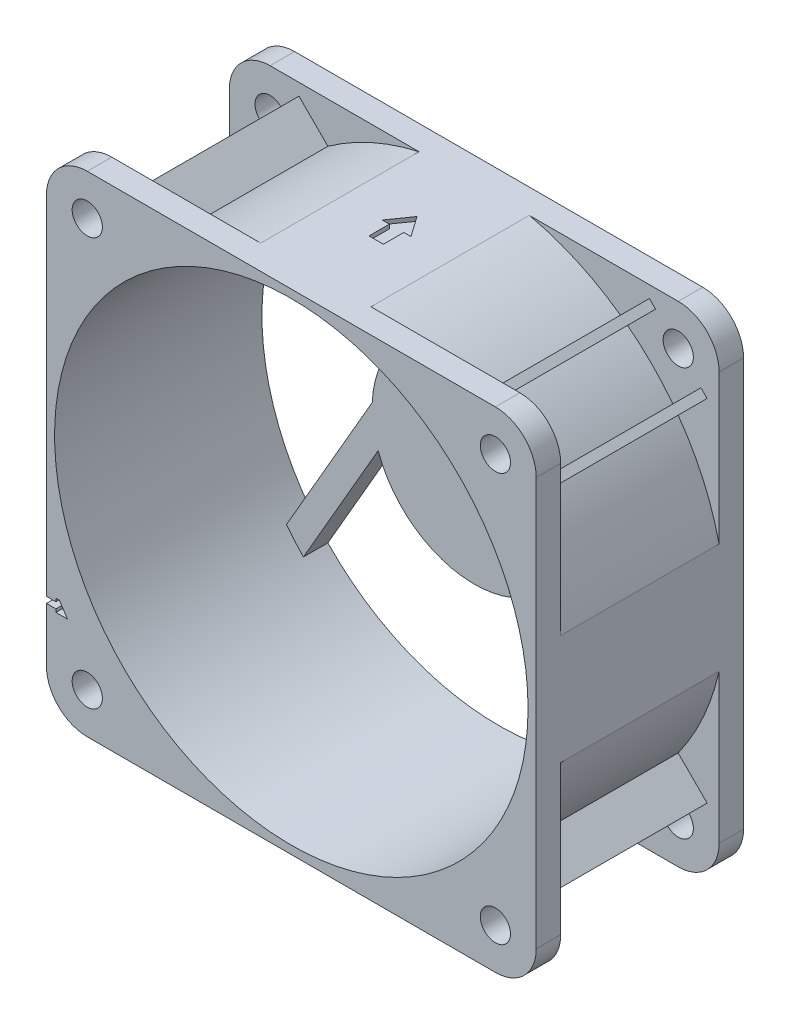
SolidWorks part; units mm, degrees
ref_plane "Front" through (0, 0, 0) normal (0, 0, 1) x (1, 0, 0)
ref_plane "Top" through (0, 0, 0) normal (0, 1, 0) x (1, 0, 0)
ref_plane "Right" through (0, 0, 0) normal (1, 0, 0) x (0, 0, -1)
sketch "Support-Front" plane through (0, 0, 0) normal (0, 0, 1) x (1, 0, 0)
  line L0 (-30, 0) -> (30, 0) construction
  line L1 (0, 30) -> (0, -30) construction
  line L2 (30, -25) -> (30, 25)
  line L3 (-30, -25) -> (-30, 25)
  line L4 (25, 30) -> (-25, 30)
  line L5 (25, -30) -> (-25, -30)
  line L6 (0, 30) -> (0, 40.3553) construction
  arc A0 (30, 25) -> (25, 30) centre (25, 25) ccw
  arc A1 (-30, 25) -> (-25, 30) centre (-25, 25) cw
  arc A2 (-30, -25) -> (-25, -30) centre (-25, -25) ccw
  arc A3 (30, -25) -> (25, -30) centre (25, -25) cw
  circle A4 centre (25, 25) radius 1.85
  circle A5 centre (-25, 25) radius 1.85
  circle A6 centre (-25, -25) radius 1.85
  circle A7 centre (25, -25) radius 1.85
  circle A8 centre (0, 0) radius 29
  circle A9 centre (0, 0) radius 12.5
  circle A10 centre (0, 0) radius 30
  circle A11 centre (0, 0) radius 40.3553 construction
  dimension "Diam-Fixing-Hole" = 3.7
  dimension "Diam-Fan-Hole" = 58
  dimension "Diam-Fixing-Plate-Fan" = 25
  dimension "Width" = 60
  dimension "Dist-Fixing-Hole" = 50
sketch "Support-Right" plane through (0, 0, 0) normal (1, 0, 0) x (0, 0, -1)
  line L0 (-25.4, 0) -> (0, 0) construction
  line L1 (-12.7, 30) -> (-12.7, -30) construction
  line L2 (-3, 30) -> (-3, -30)
  line L3 (-25.4, 30) -> (0, 30)
  line L4 (-25.4, 30) -> (-25.4, -30)
  line L5 (-25.4, -30) -> (0, -30)
  line L6 (0, 30) -> (0, -30)
  line L7 (-22.4, 30) -> (-22.4, -30)
  line L8 (-12.7, 30) -> (-12.7, 31.5) construction
  line L9 (0, 0) -> (-1.5, 0) construction
  line L10 (-1.5, 0) -> (-3, 0) construction
  dimension "Thickness" = 25.4
  dimension "Thickness-Flange" = 3
sketch "Support-Front-Reinforcment-Place" plane through (0, 0, 0) normal (0, 0, 1) x (1, 0, 0)
  line L0 (0, 30) -> (0, 0) construction
  line L1 (0, 29) -> (0, 30) construction
  line L2 (9.459, 30) -> (9.9454, 27.2413)
  line L3 (25, 30) -> (-25, 30) construction
  line L4 (-9.459, 30) -> (-9.9454, 27.2413)
  line L5 (9.459, 30) -> (0, 0) construction
  line L6 (-9.459, 30) -> (0, 0) construction
  line L7 (9.459, 30) -> (-9.459, 30)
  circle A3 centre (0, 0) radius 29 construction
  arc A4 (9.9454, 27.2413) -> (-9.9454, 27.2413) centre (0, 0) ccw
  point P10 (0, 29.5)
  dimension "D1" = 20
  dimension "D2" = 35
sketch "Support-Front-Reinforcment-Strip" plane through (0, 0, 0) normal (0, 0, 1) x (1, 0, 0)
  line L0 (17.381, 24.452) -> (21.4645, 28.5355)
  line L1 (24.452, 17.381) -> (28.5355, 21.4645)
  line L2 (25, 25) -> (0, 0) construction
  line L3 (28.5355, 21.4645) -> (27.7796, 22.2204)
  line L4 (21.4645, 28.5355) -> (22.2204, 27.7796)
  line L5 (27.7796, 22.2204) -> (23.8099, 18.2507)
  line L6 (22.2204, 27.7796) -> (18.2507, 23.8099)
  line L7 (25, 25) -> (23.8099, 18.2507) construction
  line L8 (25, 25) -> (18.2507, 23.8099) construction
  line L9 (29.2915, 20.7085) -> (25.8374, 17.2544)
  line L10 (20.7085, 29.2915) -> (17.2544, 25.8374)
  line L11 (29.2915, 20.7085) -> (29.2915, 10.3584)
  line L12 (20.7085, 29.2915) -> (10.3584, 29.2915)
  line L13 (28.5355, 21.4645) -> (29.2915, 20.7085) construction
  line L14 (21.4645, 28.5355) -> (20.7085, 29.2915) construction
  line L15 (21.9691, 21.9691) -> (21.2132, 21.2132) construction
  line L16 (20.7085, 29.2915) -> (22.2204, 27.7796) construction
  line L17 (-28.8419, -17.5957) -> (-30, -17.5957)
  line L18 (-30, -25) -> (-30, 25) construction
  line L19 (-28.8419, -17.2194) -> (-28.8419, -17.5957)
  line L20 (-28.8419, -17.2194) -> (-28.3997, -17.2194)
  line L21 (-27.4306, -18.7246) -> (-28.8419, -18.7246)
  line L22 (-28.8419, -18.3483) -> (-30, -18.3483)
  line L23 (-28.8419, -18.3483) -> (-28.8419, -18.7246)
  line L24 (-28.8419, -18.3483) -> (-27.6837, -18.3483) construction
  line L25 (-30, -17.972) -> (-25.3435, -17.972) construction
  line L26 (-27.6717, -17.972) -> (-27.6717, -17.5957) construction
  line L27 (-27.6717, -17.972) -> (-27.6717, -18.3483) construction
  line L28 (-28.8419, -18.3483) -> (-30, -17.972) construction
  line L29 (-25, -25) -> (-30, -25) construction
  line L30 (-27.5, -17.972) -> (-27.5, -21.486) construction
  line L31 (-27.5, -17.972) -> (-27.5, -14.458) construction
  line L32 (-27.5, -21.486) -> (-27.5, -25) construction
  line L33 (-25, -25) -> (-23.4846, -23.4846) construction
  line L34 (-23.4846, -23.4846) -> (-21.9691, -21.9691) construction
  arc A0 (21.4645, 28.5355) -> (28.5355, 21.4645) centre (25, 25) cw
  arc A1 (30, 25) -> (25, 30) centre (25, 25) ccw construction
  circle A2 centre (0, 0) radius 31.069
  circle A3 centre (0, 0) radius 30 construction
  circle A4 centre (0, 0) radius 33.2122 construction
  arc A6 (24.452, 17.381) -> (17.381, 24.452) centre (0, 0) ccw
  dimension "D1" = 35
  dimension "D2" = 45
  dimension "D3" = 18
  dimension "D4" = 45
sketch "Support-Front-Bone" plane through (0, 0, 0) normal (0, 0, 1) x (1, 0, 0)
  line L0 (-12.3101, -2.1706) -> (-21.9794, -18.9184) construction
  line L1 (-12.4892, 0.5192) -> (-22.9926, -17.6732)
  line L2 (-11.7643, -4.2252) -> (-20.9201, -20.0836)
  line L3 (0, 0) -> (0, 30) construction
  line L4 (25, 30) -> (-25, 30) construction
  line L6 (0, 0) -> (-12.3101, -2.1706) construction
  circle A0 centre (0, 0) radius 29 construction
  circle A1 centre (0, 0) radius 12.5 construction
  arc A2 (-12.4892, 0.5192) -> (-11.7643, -4.2252) centre (0, 0) ccw
  arc A3 (-22.9926, -17.6732) -> (-20.9201, -20.0836) centre (0, 0) ccw
  dimension "Angle-Bone" = 210
  dimension "Angle-Place-Bone" = 260
sketch "Support-Air-Exhaust" plane through (0, 0, 0) normal (0, 1, 0) x (1, 0, 0)
  line L0 (0, 0) -> (0, -10) construction
  line L1 (0, -10) -> (0, -12.5) construction
  line L2 (0, -12.5) -> (0, -15) construction
  line L3 (0, -15) -> (0, -10) construction
  line L4 (0, -10) -> (-1.7505, -12.5)
  line L5 (-1.7505, -12.5) -> (-0.8816, -12.5)
  line L6 (-0.8816, -12.5) -> (-0.8816, -15)
  line L7 (0.8816, -15) -> (-0.8816, -15)
  line L8 (0, -10) -> (-0.8816, -15) construction
  line L9 (-0.8816, -12.5) -> (0, -12.5) construction
  line L10 (0.8816, -12.5) -> (0.8816, -15)
  line L11 (1.7505, -12.5) -> (0.8816, -12.5)
  line L12 (0, -10) -> (1.7505, -12.5)
  dimension "D1" = 10
  dimension "D2" = 5
  dimension "D3" = 35
  dimension "D4" = 10
ref_plane "Plane1" through (0, 0, 25.4) normal (0, 0, 1) x (1, 0, 0)
ref_plane "Plane2" through (0, 29.5, 0) normal (0, 1, 0) x (-1, 0, 0)
sketch "Sketch-Body" plane through (0, 0, 0) normal (0, 0, 1) x (1, 0, 0)
  line L4 (-25, -30) -> (25, -30)
  line L5 (-30, 25) -> (-30, -25)
  line L6 (25, 30) -> (-25, 30)
  line L7 (30, -25) -> (30, 25)
  line L8 (-25, -30) -> (25, -30)
  line L9 (-30, 25) -> (-30, -25)
  line L10 (25, 30) -> (-25, 30)
  line L11 (30, -25) -> (30, 25)
  circle A0 centre (0, 0) radius 29 construction
  circle A1 centre (0, 0) radius 29
  arc A4 (-30, -25) -> (-25, -30) centre (-25, -25) ccw
  arc A5 (-25, 30) -> (-30, 25) centre (-25, 25) ccw
  arc A6 (30, 25) -> (25, 30) centre (25, 25) ccw
  arc A7 (25, -30) -> (30, -25) centre (25, -25) ccw
  arc A8 (-30, -25) -> (-25, -30) centre (-25, -25) ccw
  arc A9 (-25, 30) -> (-30, 25) centre (-25, 25) ccw
  arc A10 (30, 25) -> (25, 30) centre (25, 25) ccw
  arc A11 (25, -30) -> (30, -25) centre (25, -25) ccw
  dimension "D1" = 0
extrude "Body" add sketch "Sketch-Body" along normal up to surface (25.4 mm away)
sketch "Sketch-Cut-Body" plane through (0, 0, 0) normal (1, 0, 0) x (0, 0, -1)
  line L0 (-25.4, 0) -> (0, 0) construction
  line L1 (-25.4, 0) -> (0, 0) construction
  line L2 (-12.7, 30) -> (-12.7, 31.5) construction
  line L5 (-22.4, 30.75) -> (-22.4, 40.3553)
  line L6 (-22.4, 40.3553) -> (-3, 40.3553)
  line L7 (-22.4, 30.75) -> (-3, 30.75)
  line L9 (-3, 40.3553) -> (-3, 30.75)
  line L10 (-3, 30) -> (-3, -30) construction
  line L11 (-22.4, 30) -> (-22.4, -30) construction
  point P9 (-12.7, 30.75)
revolve "Cut-Body" cut sketch "Sketch-Cut-Body" angle 360 about L1
sketch "Sketch-Reinforcment-Strip" plane through (0, 0, 0) normal (0, 0, 1) x (1, 0, 0)
  line L0 (24.452, 17.381) -> (28.5355, 21.4645) construction
  line L1 (17.381, 24.452) -> (21.4645, 28.5355) construction
  line L2 (24.452, 17.381) -> (28.5355, 21.4645)
  line L3 (17.381, 24.452) -> (21.4645, 28.5355)
  line L4 (27.7796, 22.2204) -> (23.8099, 18.2507) construction
  line L5 (28.5355, 21.4645) -> (27.7796, 22.2204) construction
  line L6 (27.7796, 22.2204) -> (23.8099, 18.2507)
  line L7 (28.5355, 21.4645) -> (27.7796, 22.2204)
  line L8 (22.2204, 27.7796) -> (18.2507, 23.8099) construction
  line L9 (21.4645, 28.5355) -> (22.2204, 27.7796) construction
  line L10 (22.2204, 27.7796) -> (18.2507, 23.8099)
  line L11 (21.4645, 28.5355) -> (22.2204, 27.7796)
  circle A1 centre (0, 0) radius 30 construction
  arc A2 (18.2507, 23.8099) -> (17.381, 24.452) centre (0, 0) ccw
  arc A3 (24.452, 17.381) -> (23.8099, 18.2507) centre (0, 0) ccw
extrude "Reinforcment-Strip" add sketch "Sketch-Reinforcment-Strip" along normal up to surface (25.4 mm away)
pattern_circular "CirPattern-Reinforcment-Strip" count 4 over 360 about axis through (0, 0, 0) along (0, 0, 1) of "Reinforcment-Strip"
sketch "Sketch-Fixing-Hole" plane through (0, 0, 0) normal (0, 0, 1) x (1, 0, 0)
  circle A0 centre (25, 25) radius 1.85 construction
  circle A1 centre (25, 25) radius 1.85
extrude "Fixing-Hole" cut sketch "Sketch-Fixing-Hole" along normal through all
pattern_circular "CirPattern-Fixing-Hole" count 4 over 360 about axis through (0, 0, 0) along (0, 0, 1) of "Fixing-Hole"
sketch "Sketch-Bone" plane through (0, 0, 0) normal (0, 0, 1) x (1, 0, 0)
  line L0 (-11.7643, -4.2252) -> (-20.9201, -20.0836) construction
  line L1 (-12.4892, 0.5192) -> (-22.9926, -17.6732) construction
  line L2 (-11.7643, -4.2252) -> (-20.9201, -20.0836)
  line L3 (-12.4892, 0.5192) -> (-22.9926, -17.6732)
  circle A0 centre (0, 0) radius 29 construction
  circle A1 centre (0, 0) radius 12.5 construction
  arc A2 (-22.9926, -17.6732) -> (-20.9201, -20.0836) centre (0, 0) ccw
  arc A3 (-12.4892, 0.5192) -> (-11.7643, -4.2252) centre (0, 0) ccw
extrude "Bone" add sketch "Sketch-Bone" along normal blind 3
pattern_circular "CirPattern-Bone" count 3 over 360 about axis through (0, 0, 0) along (0, 0, 1) of "Bone"
sketch "Sketch1" plane through (0, 0, 25.4) normal (0, 0, 1) x (1, 0, 0)
  line L2 (-27.4306, -18.7246) -> (-28.8419, -18.7246) construction
  line L3 (-28.8419, -18.3483) -> (-28.8419, -18.7246) construction
  line L6 (-28.8419, -18.3483) -> (-30, -18.3483) construction
  line L7 (-30, -25) -> (-30, 25) construction
  line L8 (-28.8419, -17.5957) -> (-30, -17.5957) construction
  line L9 (-28.8419, -17.2194) -> (-28.8419, -17.5957) construction
  line L10 (-28.8419, -17.2194) -> (-28.3997, -17.2194) construction
  line L11 (-27.4306, -18.7246) -> (-28.8419, -18.7246)
  line L12 (-28.8419, -18.3483) -> (-28.8419, -18.7246)
  line L13 (-28.8419, -18.3483) -> (-30, -18.3483)
  line L14 (-30, -18.3483) -> (-30, -17.5957)
  line L15 (-28.8419, -17.5957) -> (-30, -17.5957)
  line L16 (-28.8419, -17.2194) -> (-28.8419, -17.5957)
  line L17 (-28.8419, -17.2194) -> (-28.3997, -17.2194)
  circle A3 centre (0, 0) radius 33.2122 construction
  arc A5 (-28.3997, -17.2194) -> (-27.4306, -18.7246) centre (0, 0) ccw
extrude "Cut-Reinforcment-Strip-Hole" cut sketch "Sketch1" against normal up to surface (22.4 mm away)
pattern_circular "CirPattern1" [suppressed] count 4 over 360
sketch "Sketch-Fixing-Plate-Fan" plane through (0, 0, 0) normal (0, 0, 1) x (1, 0, 0)
  circle A0 centre (0, 0) radius 12.5 construction
  circle A1 centre (0, 0) radius 12.5
extrude "Fixing-Plate-Fan" add sketch "Sketch-Fixing-Plate-Fan" along normal blind 3
sketch "Sketch4" plane through (0, 29.5, 0) normal (0, 1, 0) x (-1, 0, 0)
  line L7 (0.8816, 15) -> (-0.8816, 15)
  line L8 (0.8816, 12.5) -> (0.8816, 15)
  line L9 (1.7505, 12.5) -> (0.8816, 12.5)
  line L10 (0, 10) -> (1.7505, 12.5)
  line L11 (-1.7505, 12.5) -> (0, 10)
  line L12 (-0.8816, 12.5) -> (-1.7505, 12.5)
  line L13 (-0.8816, 15) -> (-0.8816, 12.5)
  line L14 (0.8816, 15) -> (-0.8816, 15)
  line L15 (0.8816, 12.5) -> (0.8816, 15)
  line L16 (1.7505, 12.5) -> (0.8816, 12.5)
  line L17 (0, 10) -> (1.7505, 12.5)
  line L18 (-1.7505, 12.5) -> (0, 10)
  line L19 (-0.8816, 12.5) -> (-1.7505, 12.5)
  line L20 (-0.8816, 15) -> (-0.8816, 12.5)
  dimension "D1" = 0
extrude "Air-Exhaust" cut sketch "Sketch4" along normal through all
equation "\"Diam-Fan-Hole@Support-Front\" = \"Width@Support-Front\"-2"
